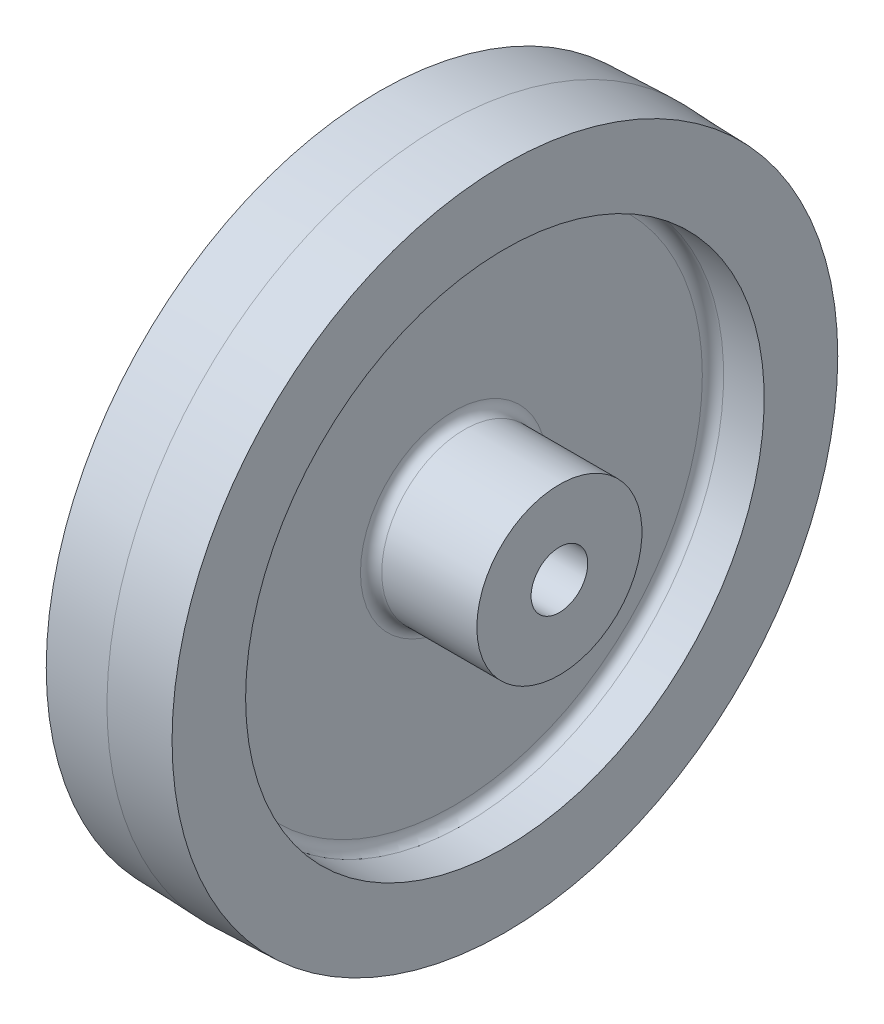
SolidWorks part; units mm, degrees
ref_plane "Ebene vorne" through (0, 0, 0) normal (0, 0, 1) x (1, 0, 0)
ref_plane "Ebene oben" through (0, 0, 0) normal (0, 1, 0) x (1, 0, 0)
ref_plane "Ebene rechts" through (0, 0, 0) normal (1, 0, 0) x (0, 0, -1)
sketch "Radkontur" plane through (0, 0, 0) normal (0, 0, 1) x (1, 0, 0)
  line L0 (-110.2975, 8.395) -> (109.4619, 8.395) construction
  line L1 (-110.26, 35) -> (110.26, 35)
  line L2 (110.26, 35) -> (110.26, 85.94)
  line L3 (110.26, 85.94) -> (10.965, 85.94)
  line L4 (10.965, 85.94) -> (10.965, 251.925)
  line L5 (10.965, 251.925) -> (59.085, 251.925)
  line L6 (59.085, 251.925) -> (59.085, 323.065)
  line L7 (59.085, 323.065) -> (-59.085, 323.065)
  line L8 (-59.085, 323.065) -> (-59.085, 251.925)
  line L9 (-59.085, 251.925) -> (-10.965, 251.925)
  line L10 (-10.965, 251.925) -> (-10.965, 85.94)
  line L11 (-10.965, 85.94) -> (-110.26, 85.94)
  line L12 (-110.26, 85.94) -> (-110.26, 35)
  line L13 (0, 0) -> (0, 349.8611) construction
  dimension "D1" = 53.21
  dimension "D2" = 629.34
  dimension "D3" = 487.06
  dimension "D4" = 155.09
  dimension "D5" = 220.52
  dimension "D6" = 118.17
  dimension "D7" = 21.93
revolve "Rotation1" add sketch "Radkontur" angle 360 about L0
fillet "Verrundung1" radius 10 1 edges at (-10.965, 8.395, 77.545)
fillet "Verrundung2" radius 10 1 edges at (-10.965, 8.395, 243.53)
fillet "Verrundung3" radius 10 1 edges at (10.965, 8.395, 243.53)
fillet "Verrundung4" radius 10 1 edges at (10.965, 8.395, 77.545)
sketch "Skizze1" plane through (0, 0, 0) normal (0, 0, 1) x (1, 0, 0)
  line L0 (0, 389.7686) -> (0, -389.7686)
draft "Formschräge1" type of draft neutral plane draft angle 2 neutral plane "Ebene rechts" faces to draft 1 parameters "D1"=2
draft "Formschräge2" type of draft neutral plane draft angle 2 neutral plane "Ebene rechts" faces to draft 1 parameters "D1"=2
